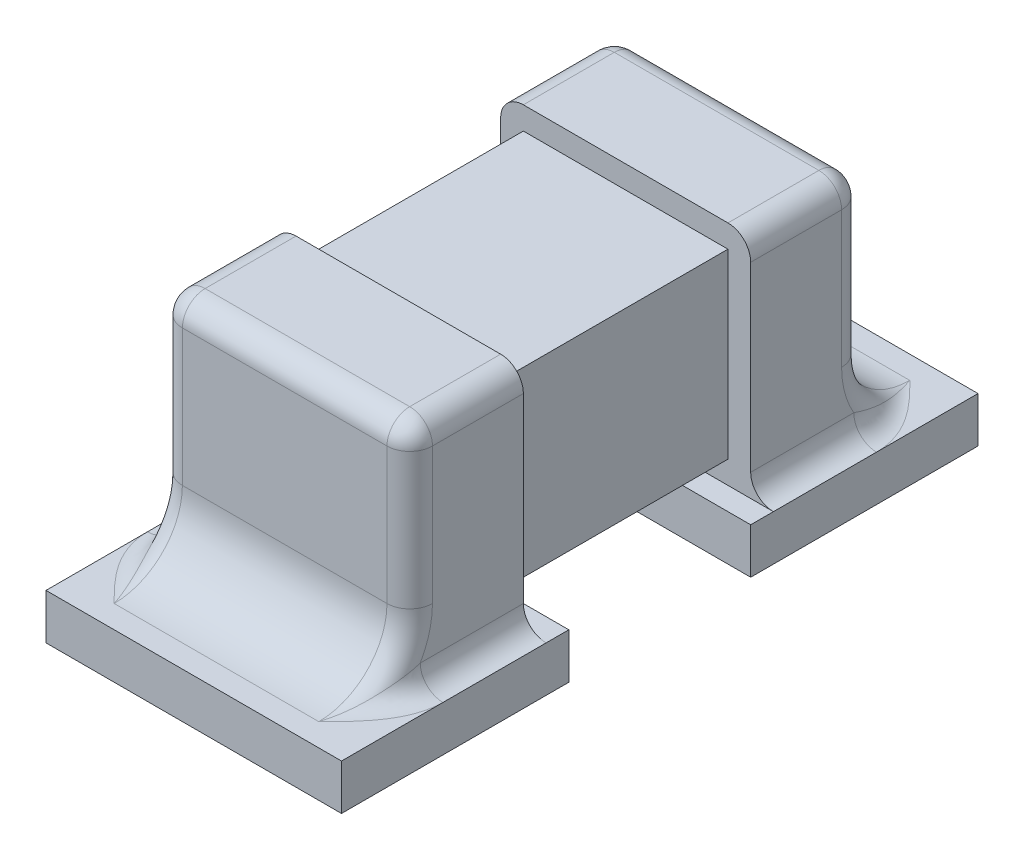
SolidWorks part; units mm, degrees
ref_plane "Plan de face" through (0, 0, 0) normal (0, 0, 1) x (1, 0, 0)
ref_plane "Plan de dessus" through (0, 0, 0) normal (0, 1, 0) x (1, 0, 0)
ref_plane "Plan de droite" through (0, 0, 0) normal (1, 0, 0) x (0, 0, -1)
sketch "Esquisse1" plane through (0, 0, 0) normal (0, 1, 0) x (1, 0, 0)
  line L1 (0, 0) -> (1.3, 0)
  line L2 (0, 0) -> (0, 1)
  line L3 (0, 1) -> (1.3, 1)
  line L4 (1.3, 0) -> (1.3, 1)
  line L5 (0, 1.8) -> (1.3, 1.8)
  line L6 (0, 1.8) -> (0, 2.8)
  line L7 (0, 2.8) -> (1.3, 2.8)
  line L8 (1.3, 1.8) -> (1.3, 2.8)
  dimension "D1" = 1.3
  dimension "D2" = 1
  dimension "D3" = 0.8
extrude "Boss.-Extru.1" add sketch "Esquisse1" along normal blind 0.2
sketch "Esquisse3" plane through (0, 0.2, 0) normal (0, 1, 0) x (1, 0, 0)
  line L0 (0, 2.8) -> (0, 1.8) construction
  line L1 (0.1, 1.9) -> (1.2, 1.9)
  line L2 (0.1, 1.9) -> (0.1, 2.4)
  line L3 (0.1, 2.4) -> (1.2, 2.4)
  line L4 (1.2, 1.9) -> (1.2, 2.4)
  line L5 (0.1, 0.9) -> (1.2, 0.9)
  line L6 (0.1, 0.9) -> (0.1, 0.4)
  line L7 (0.1, 0.4) -> (1.2, 0.4)
  line L8 (1.2, 0.9) -> (1.2, 0.4)
  line L9 (1.3, 1.8) -> (1.3, 2.8) construction
  line L10 (0, 1.8) -> (1.3, 1.8) construction
  line L12 (1.3, 1) -> (0, 1) construction
  dimension "D1" = 0.1
  dimension "D2" = 0.1
  dimension "D3" = 0.1
  dimension "D4" = 0.5
  dimension "D5" = 0.1
  dimension "D6" = 0.5
extrude "Boss.-Extru.3" add sketch "Esquisse3" along normal blind 1
fillet "Congé5" radius 0.3 1 edges at (0.65, 0.2, -0.4)
fillet "Congé6" radius 0.3 1 edges at (0.65, 0.2, -2.4)
fillet "Congé7" radius 0.1 9 edges at (1.2, 0.2879, -2.4879) (0.1, 0.2879, -2.4879) (1.2, 0.2, -2.3) (0.1, 0.2, -2.3) (1.2, 0.85, -2.4) (0.1, 0.85, -2.4) (0.65, 1.2, -2.4) (1.2, 1.2, -2.15) (0.1, 1.2, -2.15)
fillet "Congé8" radius 0.1 9 edges at (1.2, 0.2879, -0.3121) (0.1, 0.2879, -0.3121) (0.1, 1.2, -0.65) (1.2, 1.2, -0.65) (1.2, 0.2, -0.5) (0.1, 0.2, -0.5) (1.2, 0.85, -0.4) (0.1, 0.85, -0.4) (0.65, 1.2, -0.4)
sketch "Esquisse4" plane through (0, 0, -1.9) normal (0, 0, 1) x (1, 0, 0)
  line L0 (1.1, 0.2) -> (1.1, 0.5) construction
  line L1 (0.2, 1.1) -> (1.1, 1.1)
  line L2 (0.2, 1.1) -> (0.2, 0.3)
  line L3 (0.2, 0.3) -> (1.1, 0.3)
  line L4 (1.1, 1.1) -> (1.1, 0.3)
extrude "Boss.-Extru.4" add sketch "Esquisse4" along normal up to next separate body
